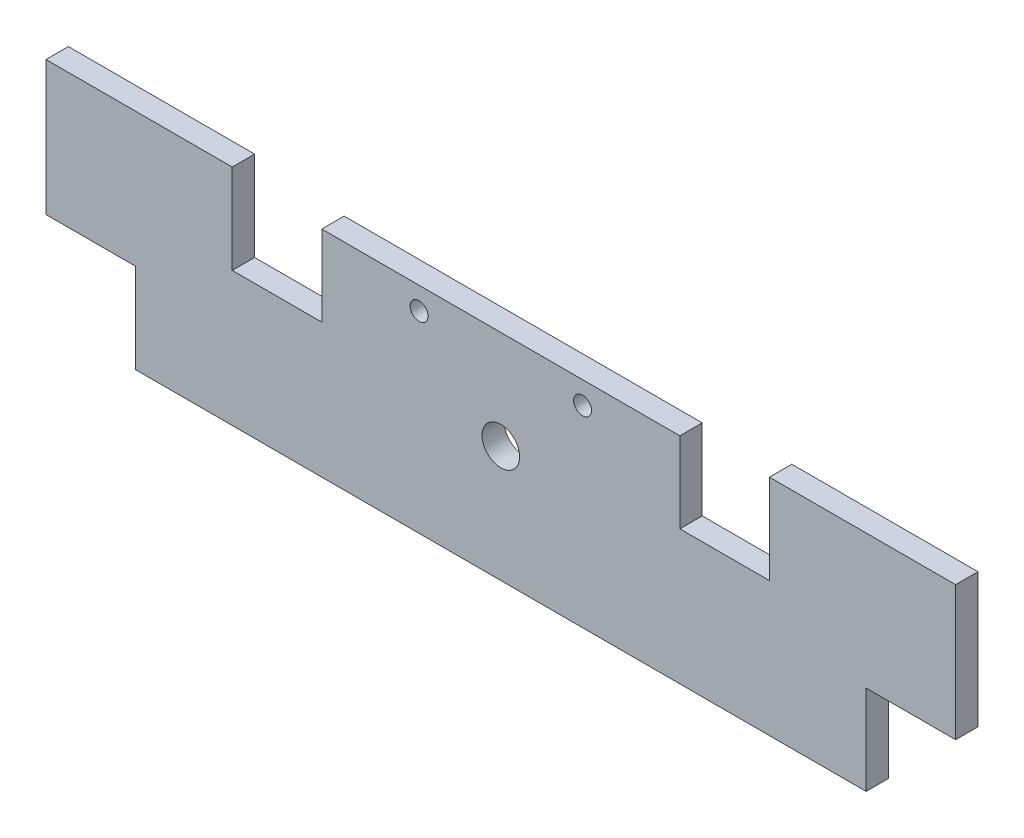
SolidWorks part; units mm, degrees
ref_plane "Front Plane" through (0, 0, 0) normal (0, 0, 1) x (1, 0, 0)
ref_plane "Top Plane" through (0, 0, 0) normal (0, 1, 0) x (1, 0, 0)
ref_plane "Right Plane" through (0, 0, 0) normal (1, 0, 0) x (0, 0, -1)
sketch "Sketch1" plane through (0, 0, 0) normal (0, 0, 1) x (1, 0, 0)
  line L0 (-508, 120) -> (508, 120)
  line L1 (508, 120) -> (508, -130)
  line L2 (508, -130) -> (-508, -130)
  line L3 (0, 0) -> (0, 120) construction
  line L4 (-508, 120) -> (-508, -130)
  circle A0 centre (0, 0) radius 21
  point P8 (0, -130)
  dimension "D1" = 42
  dimension "D3" = 120
  dimension "D2" = 1016
  dimension "D4" = 250
extrude "Boss-Extrude1" add sketch "Sketch1" along normal mid plane 25
sketch "Sketch2" plane through (0, 0, 12.5) normal (0, 0, 1) x (1, 0, 0)
  line L0 (508, 120) -> (-508, 120) construction
  line L1 (-300, 120) -> (-200, 120)
  line L2 (-300, 120) -> (-300, 20)
  line L3 (-300, 20) -> (-200, 20)
  line L4 (-200, 120) -> (-200, 20)
  line L5 (0, 0) -> (0, 120) construction
  line L6 (200, 120) -> (200, 20)
  line L7 (300, 20) -> (200, 20)
  line L8 (300, 120) -> (300, 20)
  line L9 (300, 120) -> (200, 120)
  line L10 (408, -130) -> (408, -30)
  line L11 (-508, -130) -> (-408, -130)
  line L12 (-508, -130) -> (-508, -30)
  line L13 (-508, -30) -> (-408, -30)
  line L14 (-408, -130) -> (-408, -30)
  line L15 (508, -30) -> (408, -30)
  line L16 (508, -130) -> (508, -30)
  line L17 (508, -130) -> (408, -130)
  dimension "D1" = 100
  dimension "D2" = 100
  dimension "D3" = 600
  dimension "D4" = 100
  dimension "D5" = 100
extrude "Cut-Extrude1" cut sketch "Sketch2" against normal through all
sketch "Sketch3" plane through (0, 120, 0) normal (0, 1, 0) x (1, 0, 0)
  circle A0 centre (0, 0) radius 317.5 construction
  circle A1 centre (0, 0) radius 381 construction
  dimension "D1" = 762
  dimension "D2" = 635
sketch "Sketch4" plane through (0, 0, 12.5) normal (0, 0, 1) x (1, 0, 0)
  line L0 (0, 0) -> (0, -130) construction
  line L1 (-408, -130) -> (408, -130) construction
  line L2 (-388, -130) -> (-373, -115)
  line L3 (-373, -115) -> (373, -115)
  line L4 (-408, -130) -> (-408, -30) construction
  line L5 (388, -130) -> (373, -115)
  point P12 (0, -115)
  dimension "D1" = 115
  dimension "D2" = 20
  dimension "D3" = 135
extrude "Cut-Extrude2" [suppressed] cut sketch "Sketch4" against normal through all and the other way through all
sketch "Sketch12" [suppressed] plane through (0, 0, -6) normal (0, 0, -1) x (-1, 0, 0)
  circle A0 centre (0, 0) radius 60.7209
extrude "Boss-Extrude2" [suppressed] add sketch "Sketch12" against normal up to surface (12 mm away)
sketch "Sketch6" plane through (0, 0, 12.5) normal (0, 0, 1) x (1, 0, 0)
  line L0 (-508, 25) -> (-300, 25)
  line L1 (-508, 120) -> (-508, -30) construction
  line L2 (-300, 25) -> (-300, 120)
  line L3 (-300, 120) -> (-508, 120)
  line L4 (-508, 120) -> (-508, 25)
  line L6 (0, 0) -> (0, 120) construction
  line L7 (381, 120) -> (-381, 120) construction
  line L8 (508, 120) -> (508, 25)
  line L9 (300, 120) -> (508, 120)
  line L10 (300, 25) -> (300, 120)
  line L11 (508, 25) -> (300, 25)
  line L12 (-300, 20) -> (-200, 20) construction
  dimension "D2" = 5
extrude "Cut-Extrude3" [suppressed] cut sketch "Sketch6" against normal through all
sketch "Sketch7" [suppressed] plane through (0, 0, 12.5) normal (0, 0, 1) x (1, 0, 0)
  line L0 (381, 120) -> (-381, 120) construction
  line L1 (-150, 70) -> (-75, 70)
  line L2 (-150, 70) -> (-150, -65)
  line L3 (-150, -65) -> (-75, -65)
  line L4 (-75, 70) -> (-75, -65)
  line L5 (373, -115) -> (-373, -115) construction
  line L6 (0, 0) -> (0, -115) construction
  line L7 (75, 70) -> (75, -65)
  line L8 (150, -65) -> (75, -65)
  line L9 (150, 70) -> (150, -65)
  line L10 (150, 70) -> (75, 70)
  line L11 (-200, 20) -> (-200, 120) construction
  dimension "D1" = 50
  dimension "D2" = 50
  dimension "D3" = 50
  dimension "D4" = 75
extrude "lightening holes" [suppressed] cut sketch "Sketch7" against normal through all
sketch "Sketch9" [suppressed] plane through (0, 0, -10) normal (0, 0, -1) x (-1, 0, 0)
  line L0 (-373, -115) -> (373, -115) construction
  line L1 (-358, -15) -> (-200, -15)
  line L2 (-358, -15) -> (-358, -90)
  line L3 (-358, -90) -> (-200, -90)
  line L4 (-200, -15) -> (-200, -90)
  line L5 (-408, -30) -> (-408, -130) construction
  line L6 (-200, 20) -> (-300, 20) construction
  line L7 (-150, -65) -> (-150, 70) construction
  line L8 (0, 0) -> (0, -115) construction
  line L9 (200, -15) -> (200, -90)
  line L10 (358, -90) -> (200, -90)
  line L11 (358, -15) -> (358, -90)
  line L12 (358, -15) -> (200, -15)
  dimension "D1" = 25
  dimension "D2" = 50
  dimension "D3" = 35
  dimension "D4" = 50
extrude "Cut-Extrude5" [suppressed] cut sketch "Sketch9" against normal through all
fillet "Fillet1" [suppressed] radius 10
sketch "Sketch10" [suppressed] plane through (0, 0, -6) normal (0, 0, -1) x (-1, 0, 0)
  line L1 (-508, 25) -> (538.0373, 25)
  line L2 (-508, 25) -> (-508, 328.4092)
  line L3 (-508, 328.4092) -> (538.0373, 328.4092)
  line L4 (538.0373, 25) -> (538.0373, 328.4092)
extrude "Cut-Extrude6" [suppressed] cut sketch "Sketch10" against normal through all
sketch "Sketch11" [suppressed] plane through (0, 0, -6) normal (0, 0, -1) x (-1, 0, 0)
  line L1 (-408, -130) -> (-618.8007, -130)
  line L2 (-408, -130) -> (-408, 84.311)
  line L3 (-408, 84.311) -> (-618.8007, 84.311)
  line L4 (-618.8007, -130) -> (-618.8007, 84.311)
  line L5 (408, -130) -> (574.7368, -130)
  line L6 (408, -130) -> (408, 70.7433)
  line L7 (408, 70.7433) -> (574.7368, 70.7433)
  line L8 (574.7368, -130) -> (574.7368, 70.7433)
extrude "Cut-Extrude7" [suppressed] cut sketch "Sketch11" against normal through all
sketch "Sketch13" [suppressed] plane through (0, 0, 6) normal (0, 0, 1) x (1, 0, 0)
  line L0 (-200, 20) -> (-185.0122, -65)
  line L1 (-300, 20) -> (-200, 20) construction
  line L2 (-185.0122, -65) -> (-314.9878, -65)
  line L3 (-200, 20) -> (-300, 20)
  line L4 (-250, 20) -> (-250, -65) construction
  line L5 (373, -115) -> (-373, -115) construction
  line L6 (-200, 20) -> (-200, 120) construction
  line L7 (-300, 20) -> (-314.9878, -65)
  dimension "D1" = 50
  dimension "D2" = 100
extrude "Cut-Extrude8" [suppressed] cut sketch "Sketch13" against normal through all
fillet "Fillet2" [suppressed] radius 25
sketch "Sketch14" [suppressed] plane through (0, 0, 6) normal (0, 0, 1) x (1, 0, 0)
  line L0 (300, 20) -> (408, -30)
  line L1 (408, -30) -> (408, -130) construction
  line L2 (408, -30) -> (408, 30.3868)
  line L3 (408, 30.3868) -> (300, 20)
  line L4 (0, -70) -> (0, -120) construction
  line L5 (-315.8694, -70) -> (-184.1306, -70) construction
  line L6 (378, -120) -> (-378, -120) construction
  line L7 (408, -30) -> (508, -30) construction
  line L8 (-408, 30.3868) -> (-300, 20)
  line L9 (-408, -30) -> (-408, 30.3868)
  line L10 (-300, 20) -> (-408, -30)
  line L12 (300, 120) -> (300, 20) construction
  line L13 (200, 20) -> (404, 20) construction
extrude "Cut-Extrude9" [suppressed] cut sketch "Sketch14" against normal through all
sketch "Sketch15" [suppressed] plane through (0, 0, -6) normal (0, 0, -1) x (-1, 0, 0)
  line L0 (-373, -115) -> (373, -115) construction
  line L1 (-358, -15) -> (-198, -15)
  line L2 (-358, -15) -> (-358, -90)
  line L3 (-358, -90) -> (-198, -90)
  line L4 (-198, -15) -> (-198, -90)
  line L5 (-200, 20) -> (-300, 20) construction
  line L6 (-408, -30) -> (-408, -130) construction
  line L7 (0, 0) -> (0, -115) construction
  line L8 (198, -15) -> (198, -90)
  line L9 (358, -90) -> (198, -90)
  line L10 (358, -15) -> (358, -90)
  line L11 (358, -15) -> (198, -15)
  line L12 (90, -15) -> (-90, -15)
  line L13 (-90, -15) -> (-90, -90)
  line L14 (-90, -90) -> (90, -90)
  line L15 (90, -15) -> (90, -90)
  point P22 (0, -90)
  point P23 (0, -15)
  dimension "D1" = 25
  dimension "D2" = 35
  dimension "D3" = 50
  dimension "D4" = 160
  dimension "D5" = 180
extrude "Cut-Extrude10" [suppressed] cut sketch "Sketch15" against normal through all
fillet "Fillet3" [suppressed] radius 10
fillet "Fillet4" [suppressed] radius 2
sketch "Sketch16" plane through (0, 0, 0) normal (0, 0, 1) x (1, 0, 0)
  line L0 (200, 120) -> (200, 20) construction
  line L1 (-200, 120) -> (200, 120)
  line L2 (-200, 120) -> (-200, 110)
  line L3 (-200, 110) -> (200, 110)
  line L4 (200, 120) -> (200, 110)
  dimension "D1" = 10
extrude "Cut-Extrude11" cut sketch "Sketch16" against normal through all both and the other way through all
sketch "Sketch17" plane through (0, 0, 0) normal (0, 0, 1) x (1, 0, 0)
  line L0 (-91.297, 85) -> (91.297, 85) construction
  line L1 (-200, 110) -> (200, 110) construction
  circle A0 centre (-91.297, 85) radius 10
  circle A1 centre (91.297, 85) radius 10
  point P4 (0, 85)
  dimension "D1" = 20
  dimension "D2" = 25
extrude "Cut-Extrude12" cut sketch "Sketch17" against normal through all both and the other way through all
